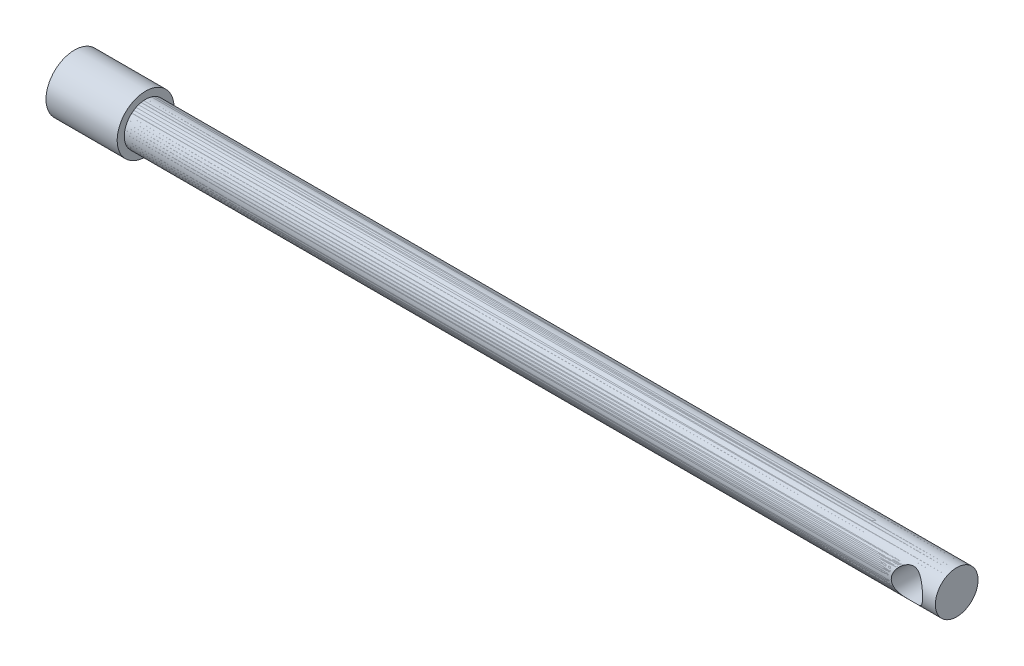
SolidWorks part; units mm, degrees
ref_plane "Plan de face" through (0, 0, 0) normal (0, 0, 1) x (1, 0, 0)
ref_plane "Plan de dessus" through (0, 0, 0) normal (0, 1, 0) x (1, 0, 0)
ref_plane "Plan de droite" through (0, 0, 0) normal (1, 0, 0) x (0, 0, -1)
imported_body "Importée1"
sketch "Esquisse1" plane through (-600, 0, 0) normal (-1, 0, 0) x (0, 0, 1)
  circle A0 centre (0, 0) radius 20
  dimension "D1" = 40
extrude "Extrusion1" add sketch "Esquisse1" against normal blind 50
